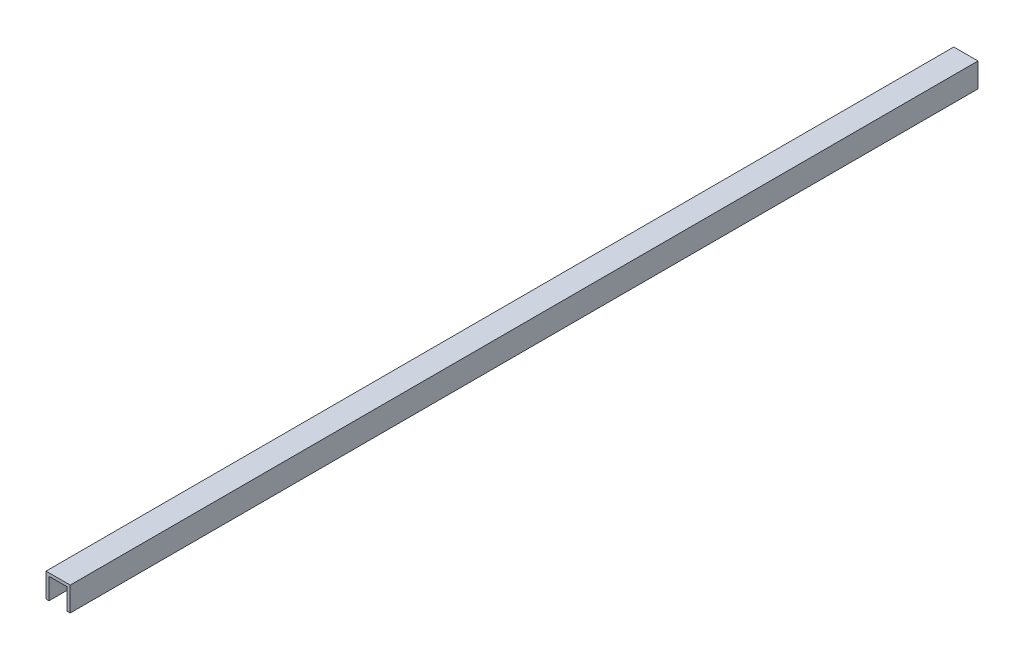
SolidWorks part; units mm, degrees
ref_plane "Ebene vorne" through (0, 0, 0) normal (0, 0, 1) x (1, 0, 0)
ref_plane "Ebene oben" through (0, 0, 0) normal (0, 1, 0) x (1, 0, 0)
ref_plane "Ebene rechts" through (0, 0, 0) normal (1, 0, 0) x (0, 0, -1)
sketch "Skizze1" plane through (0, 0, 0) normal (0, 0, 1) x (1, 0, 0)
  line L1 (4, -4) -> (-4, -4)
  line L2 (4, -4) -> (4, 4)
  line L3 (4, 4) -> (-4, 4)
  line L4 (-4, -4) -> (-4, 4)
  line L5 (4, -4) -> (-4, 4) construction
  line L6 (4, 4) -> (-4, -4) construction
  point P0 (0, 0)
  dimension "D1" = 8
extrude "Aufsatz-Linear austragen1" add sketch "Skizze1" along normal mid plane 300 contours L3 L4 L1 L2
shell "Wandung1" thickness 1
